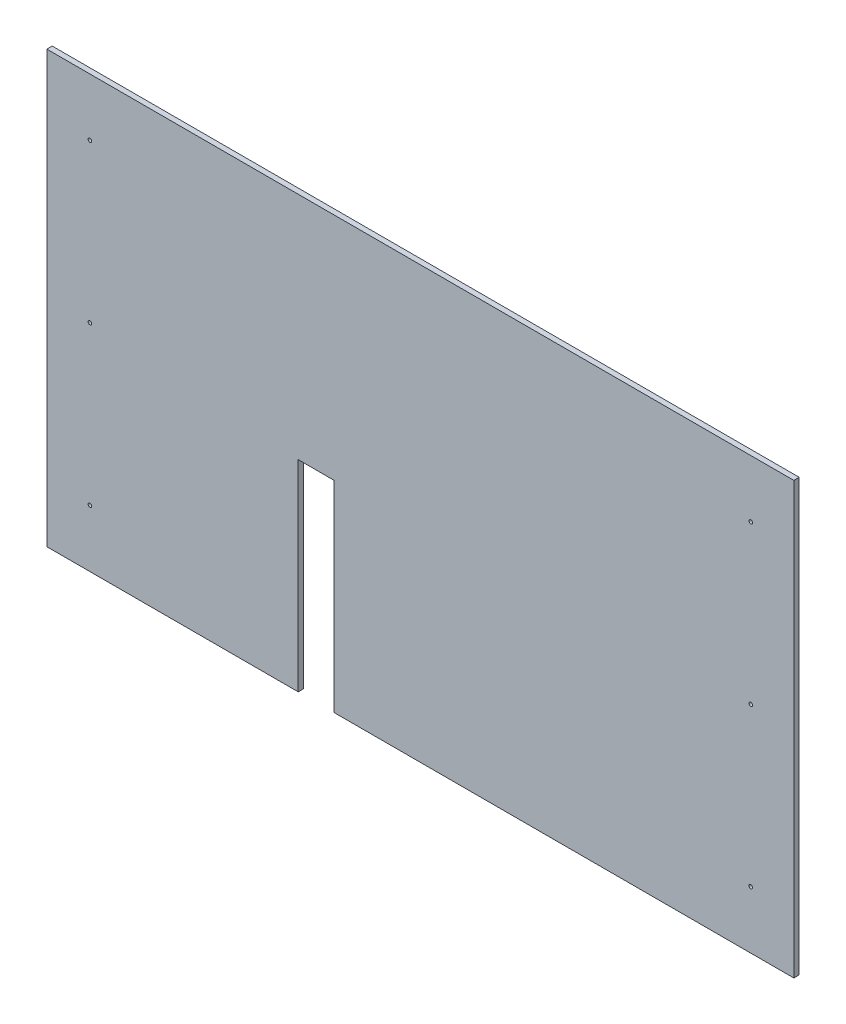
SolidWorks part; units mm, degrees
ref_plane "Front Plane" through (0, 0, 0) normal (0, 0, 1) x (1, 0, 0)
ref_plane "Top Plane" through (0, 0, 0) normal (0, 1, 0) x (1, 0, 0)
ref_plane "Right Plane" through (0, 0, 0) normal (1, 0, 0) x (0, 0, -1)
sketch "Sketch1" plane through (0, 0, 0) normal (0, 0, 1) x (1, 0, 0)
  line L1 (0, 0) -> (330.2, 0)
  line L2 (0, 0) -> (0, -190.5)
  line L3 (0, -190.5) -> (330.2, -190.5)
  line L4 (330.2, 0) -> (330.2, -190.5)
  dimension "D1" = 330.2
  dimension "D2" = 190.5
extrude "Boss-Extrude1" add sketch "Sketch1" along normal blind 2.3622
sketch "Sketch13" plane through (0, 0, 0) normal (0, 0, -1) x (-1, 0, 0)
  line L0 (0, -190.5) -> (-330.2, -190.5) construction
  line L1 (-127, -101.6) -> (-111.125, -101.6)
  line L2 (-127, -101.6) -> (-127, -190.5)
  line L3 (-127, -190.5) -> (-111.125, -190.5)
  line L4 (-111.125, -101.6) -> (-111.125, -190.5)
  dimension "D1" = 111.125
  dimension "D2" = 15.875
  dimension "D3" = 88.9
extrude "Cut-Extrude1" cut sketch "Sketch13" against normal through all
hole_wizard "1/16 (0.0625) Diameter Hole1" positions "Sketch14" profile "Sketch15" hole size "1/16" standard "ANSI Inch"
sketch "Sketch14" plane through (0, 0, 2.3622) normal (0, 0, 1) x (1, 0, 0)
  point P0 (19.05, -25.4)
  point P2 (19.05, -95.25)
  point P4 (19.05, -165.1)
  point P6 (311.15, -25.4)
  point P8 (311.15, -95.25)
  point P10 (311.15, -165.1)
  dimension "D1" = 25.4
  dimension "D2" = 95.25
  dimension "D3" = 25.4
  dimension "D4" = 19.05
  dimension "D5" = 19.05
sketch "Sketch15" plane through (19.05, -25.4, 2.3622) normal (1, 0, 0) x (0, -1, 0)
  line L0 (0, 0) -> (0, 2.3622)
  line L1 (0, 2.3622) -> (0.7937, 2.3622)
  line L2 (0.7937, 2.3622) -> (0.7937, 0)
  line L5 (0.7937, 0) -> (0, 0)
  line L11 (0, -6.35) -> (0, 107.95) construction
  dimension "Thru Hole Dia." = 1.5875
  dimension "Thru Hole Depth" = 2.3622
